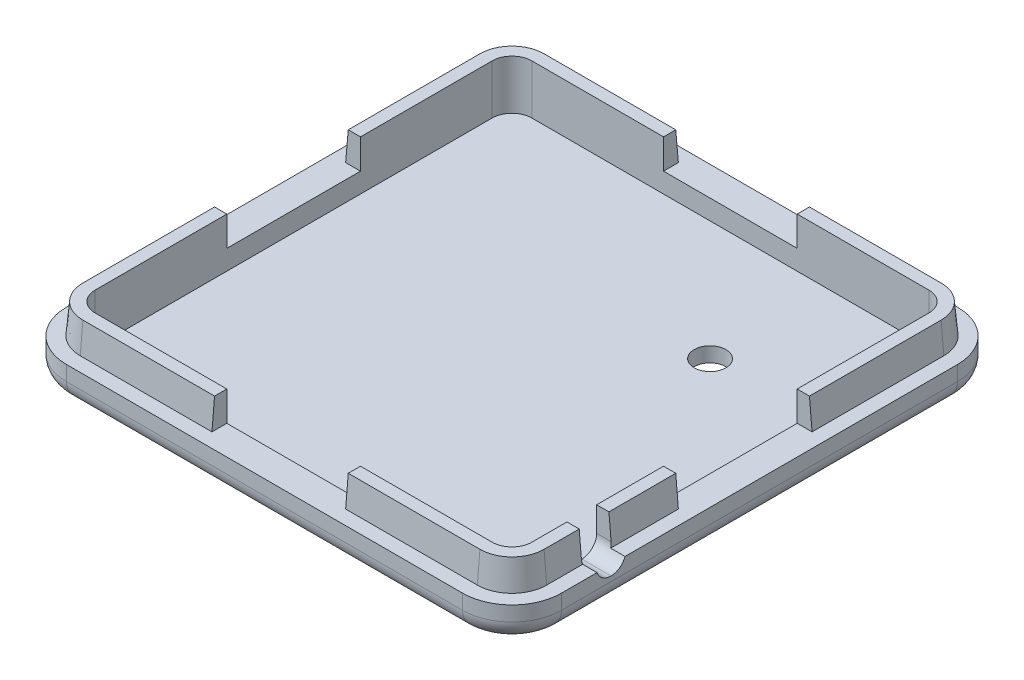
SolidWorks part; units mm, degrees
ref_plane "Plan de face" through (0, 0, 0) normal (0, 0, 1) x (1, 0, 0)
ref_plane "Plan de dessus" through (0, 0, 0) normal (0, 1, 0) x (1, 0, 0)
ref_plane "Plan de droite" through (0, 0, 0) normal (1, 0, 0) x (0, 0, -1)
sketch "Esquisse1" plane through (0, 0, 0) normal (0, 1, 0) x (1, 0, 0)
  line L1 (-155.1718, -2.6693) -> (-115.1718, -2.6693)
  line L2 (-160.1718, -7.6693) -> (-160.1718, -47.6693)
  line L3 (-155.1718, -52.6693) -> (-115.1718, -52.6693)
  line L4 (-110.1718, -7.6693) -> (-110.1718, -47.6693)
  line L5 (-160.1718, -2.6693) -> (-110.1718, -52.6693) construction
  line L6 (-160.1718, -52.6693) -> (-110.1718, -2.6693) construction
  arc A0 (-160.1718, -47.6693) -> (-155.1718, -52.6693) centre (-155.1718, -47.6693) ccw
  arc A1 (-115.1718, -52.6693) -> (-110.1718, -47.6693) centre (-115.1718, -47.6693) ccw
  arc A2 (-115.1718, -2.6693) -> (-110.1718, -7.6693) centre (-115.1718, -7.6693) cw
  arc A3 (-155.1718, -2.6693) -> (-160.1718, -7.6693) centre (-155.1718, -7.6693) ccw
  point P0 (-135.1718, -27.6693)
  dimension "D3" = 5
  dimension "D1" = 50
  dimension "D2" = 50
extrude "Boss.-Extru.1" add sketch "Esquisse1" along normal blind 3.5
shell "Coque1" thickness 1.5
sketch "Esquisse6" plane through (0, 1.5, 0) normal (0, 1, 0) x (1, 0, 0)
  line L0 (-135.1718, -4.1693) -> (-135.1718, -55.2403) construction
  line L2 (-158.6718, -27.6693) -> (-95.4543, -27.6693) construction
  line L3 (-158.6718, -7.6693) -> (-158.6718, -47.6693) construction
  line L6 (-115.1718, -4.1693) -> (-155.1718, -4.1693) construction
  line L7 (-155.2218, -5.6193) -> (-115.1218, -5.6193)
  line L8 (-155.2218, -51.2193) -> (-115.1218, -51.2193)
  line L9 (-158.7218, -47.7193) -> (-158.7218, -7.6193)
  line L10 (-155.2218, -4.1193) -> (-115.1218, -4.1193)
  line L11 (-111.6218, -47.7193) -> (-111.6218, -7.6193)
  line L12 (-158.7218, -51.2193) -> (-111.6218, -4.1193) construction
  line L13 (-158.7218, -4.1193) -> (-111.6218, -51.2193) construction
  line L14 (-113.1218, -47.7193) -> (-113.1218, -7.6193)
  line L15 (-155.2218, -49.7193) -> (-115.1218, -49.7193)
  line L16 (-157.2218, -47.7193) -> (-157.2218, -7.6193)
  arc A1 (-115.1218, -51.2193) -> (-111.6218, -47.7193) centre (-115.1218, -47.7193) ccw
  arc A2 (-155.2218, -51.2193) -> (-158.7218, -47.7193) centre (-155.2218, -47.7193) cw
  arc A3 (-158.7218, -7.6193) -> (-155.2218, -4.1193) centre (-155.2218, -7.6193) cw
  arc A4 (-115.1218, -4.1193) -> (-111.6218, -7.6193) centre (-115.1218, -7.6193) cw
  arc A5 (-115.1218, -5.6193) -> (-113.1218, -7.6193) centre (-115.1218, -7.6193) cw
  arc A6 (-115.1218, -49.7193) -> (-113.1218, -47.7193) centre (-115.1218, -47.7193) ccw
  arc A7 (-155.2218, -49.7193) -> (-157.2218, -47.7193) centre (-155.2218, -47.7193) cw
  arc A8 (-157.2218, -7.6193) -> (-155.2218, -5.6193) centre (-155.2218, -7.6193) cw
  point P0 (-135.1718, -27.6693)
  dimension "D3" = 3.5
  dimension "D4" = 1.5
  dimension "D1" = 47.1
  dimension "D2" = 47.1
extrude "Boss.-Extru.4" add sketch "Esquisse6" along normal blind 5
sketch "Esquisse4" plane through (0, 3.5, 0) normal (0, 1, 0) x (1, 0, 0)
  line L0 (-157.2218, -27.6693) -> (-143.7218, -27.6693) construction
  line L2 (-157.2218, -7.6193) -> (-157.2218, -47.7193) construction
  line L4 (-135.1718, -5.6193) -> (-135.1718, -71.9499) construction
  line L5 (-115.1218, -5.6193) -> (-155.2218, -5.6193) construction
  line L6 (-111.6218, -47.7193) -> (-111.6218, -7.6193) construction
  line L7 (-118.1475, -20.9193) -> (-105.0961, -20.9193)
  line L8 (-118.1475, -20.9193) -> (-118.1475, -34.4193)
  line L9 (-118.1475, -34.4193) -> (-105.0961, -34.4193)
  line L10 (-105.0961, -20.9193) -> (-105.0961, -34.4193)
  line L11 (-118.1475, -20.9193) -> (-105.0961, -34.4193) construction
  line L12 (-118.1475, -34.4193) -> (-105.0961, -20.9193) construction
  line L13 (-157.2218, -27.6693) -> (-100.8277, -27.6693) construction
  line L14 (-135.1718, -51.2193) -> (-135.1718, -20.0179) construction
  line L15 (-155.2218, -51.2193) -> (-115.1218, -51.2193) construction
  line L16 (-158.7218, -47.7193) -> (-158.7218, -7.6193) construction
  line L17 (-162.2934, -20.9193) -> (-155.1503, -20.9193)
  line L18 (-162.2934, -20.9193) -> (-162.2934, -34.4193)
  line L19 (-162.2934, -34.4193) -> (-155.1503, -34.4193)
  line L20 (-155.1503, -20.9193) -> (-155.1503, -34.4193)
  line L21 (-162.2934, -20.9193) -> (-155.1503, -34.4193) construction
  line L22 (-162.2934, -34.4193) -> (-155.1503, -20.9193) construction
  line L23 (-155.2218, -4.1193) -> (-115.1218, -4.1193) construction
  line L24 (-141.9218, -0.7534) -> (-128.4218, -0.7534)
  line L25 (-141.9218, -0.7534) -> (-141.9218, -7.4852)
  line L26 (-141.9218, -7.4852) -> (-128.4218, -7.4852)
  line L27 (-128.4218, -0.7534) -> (-128.4218, -7.4852)
  line L28 (-141.9218, -0.7534) -> (-128.4218, -7.4852) construction
  line L29 (-141.9218, -7.4852) -> (-128.4218, -0.7534) construction
  line L31 (-141.9218, -48.3836) -> (-128.4218, -48.3836)
  line L32 (-141.9218, -48.3836) -> (-141.9218, -54.0551)
  line L33 (-141.9218, -54.0551) -> (-128.4218, -54.0551)
  line L34 (-128.4218, -48.3836) -> (-128.4218, -54.0551)
  line L35 (-141.9218, -48.3836) -> (-128.4218, -54.0551) construction
  line L36 (-141.9218, -54.0551) -> (-128.4218, -48.3836) construction
  point P8 (-111.6218, -27.6693)
  point P20 (-158.7218, -27.6693)
  point P27 (-135.1718, -4.1193)
  dimension "D1" = 13.5
  dimension "D2" = 13.5
  dimension "D3" = 13.5
  dimension "D4" = 13.5
extrude "Enlèv. mat.-Extru.1" cut sketch "Esquisse4" along normal blind 15
sketch "Esquisse7" plane through (0, 1.5, 0) normal (0, 1, 0) x (1, 0, 0)
  line L0 (-157.2218, -14.2693) -> (-101.3548, -14.2693) construction
  line L1 (-157.2218, -7.6193) -> (-157.2218, -20.9193) construction
  line L2 (-135.1718, -5.6193) -> (-135.1718, -58.5495) construction
  line L3 (-115.1218, -5.6193) -> (-155.2218, -5.6193) construction
draft "Dépouille1" draft angle 5 faces to draft 12 parameters "D1"=5
fillet "Congé6" radius 2 8 edges at (-110.1718, 0, 27.6693) (-111.6363, 0, 51.2049) (-135.1718, 0, 52.6693) (-158.7073, 0, 51.2049) (-160.1718, 0, 27.6693) (-158.7073, 0, 4.1338) (-111.6363, 0, 4.1338) (-135.1718, 0, 2.6693)
sketch "Esquisse8" plane through (0, 0, 0) normal (0, -1, 0) x (1, 0, 0)
  line L0 (-157.2931, 49.7906) -> (-109.1011, 1.5986) construction
  line L1 (-157.2931, 5.548) -> (-109.1011, 53.7401) construction
  line L2 (-149.3792, 7.8551) -> (-104.5124, 52.7219) construction
  arc A0 (-155.1718, 50.6693) -> (-158.1718, 47.6693) centre (-155.1718, 47.6693) ccw construction
  arc A1 (-158.1718, 7.6693) -> (-155.1718, 4.6693) centre (-155.1718, 7.6693) ccw construction
  text T0 "Hub USB" font "Arial Narrow" height 10
extrude "Boss.-Extru.5" add sketch "Esquisse8" along normal blind 0.5
sketch "Esquisse9" plane through (0, 6.5, 0) normal (0, 1, 0) x (1, 0, 0)
  line L0 (-157.2218, -27.6693) -> (-113.9284, -27.6693) construction
  line L1 (-157.2218, -20.9193) -> (-157.2218, -34.4193) construction
  line L2 (-128.0697, -42.6693) -> (-102.7332, -42.6693) construction
  line L4 (-119.2314, -41.1693) -> (-106.1002, -41.1693)
  line L5 (-119.2314, -41.1693) -> (-119.2314, -44.1693)
  line L6 (-119.2314, -44.1693) -> (-106.1002, -44.1693)
  line L7 (-106.1002, -41.1693) -> (-106.1002, -44.1693)
  line L8 (-119.2314, -41.1693) -> (-106.1002, -44.1693) construction
  line L9 (-119.2314, -44.1693) -> (-106.1002, -41.1693) construction
  point P6 (-112.6658, -42.6693)
  dimension "D1" = 15
  dimension "D2" = 3
extrude "Enlèv. mat.-Extru.2" cut sketch "Esquisse9" against normal blind 4
fillet "Congé7" radius 1.5 2 edges at (-111.6468, 2.5, 44.1693) (-111.6468, 2.5, 41.1693)
sketch "Esquisse10" plane through (0, 0, 0) normal (0, -1, 0) x (1, 0, 0)
  line L0 (-135.1718, 50.6693) -> (-135.1718, 10.9967) construction
  line L1 (-115.1718, 50.6693) -> (-155.1718, 50.6693) construction
  line L2 (-135.1718, 5.6193) -> (-135.1718, 58.5495) construction
  line L3 (-158.1718, 27.6693) -> (-115.1718, 27.6693) construction
  line L4 (-158.1718, 47.6693) -> (-158.1718, 7.6693) construction
  line L5 (-125.1718, 29.6835) -> (-125.1718, 10.3234) construction
  line L6 (-137.5815, 17.6693) -> (-116.4537, 17.6693) construction
  circle A0 centre (-125.1718, 17.6693) radius 1.6
  dimension "D1" = 10
  dimension "D2" = 10
extrude "Enlèv. mat.-Extru.3" cut sketch "Esquisse10" against normal blind 32
